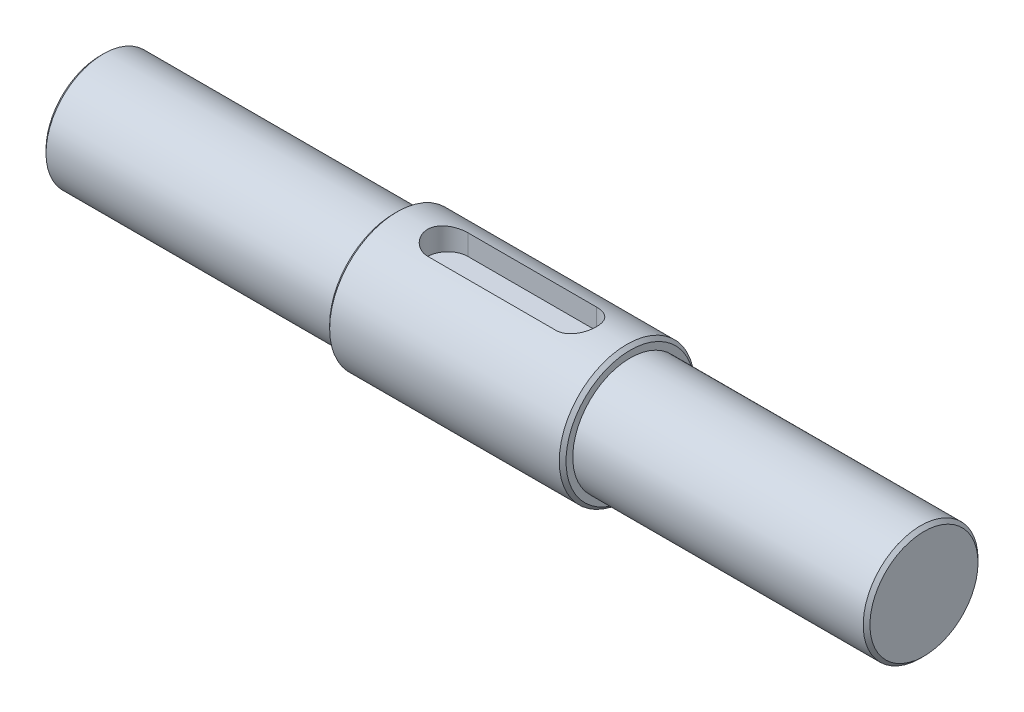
SolidWorks part; units mm, degrees
ref_plane "Front Plane" through (0, 0, 0) normal (0, 0, 1) x (1, 0, 0)
ref_plane "Top Plane" through (0, 0, 0) normal (0, 1, 0) x (1, 0, 0)
ref_plane "Right Plane" through (0, 0, 0) normal (1, 0, 0) x (0, 0, -1)
ref_plane "Plane1" through (0, 0, 0) normal (0, 0, -1) x (-1, 0, 0)
sketch "Sketch1" plane through (0, 0, 0) normal (0, 0, -1) x (-1, 0, 0)
  line L0 (-78.5, 10) -> (-78.5, 0)
  line L1 (-78.5, 0) -> (-43.5, 0)
  line L2 (-43.5, 0) -> (-43.5, 10)
  line L3 (-43.5, 10) -> (-78.5, 10)
  line L4 (-78.5, 0) -> (-43.5, 0) construction
  dimension "D1" = 35
  dimension "D2" = 10
revolve "Revolve1" add sketch "Sketch1" angle 360 about L4
sketch "Sketch2" plane through (78.5, 0, 0) normal (1, 0, 0) x (0, 0, -1)
  circle A0 centre (0, 0) radius 8.5
  dimension "D1" = 17
extrude "Boss-Extrude1" add sketch "Sketch2" along normal blind 43.5
sketch "Sketch3" plane through (43.5, 0, 0) normal (-1, 0, 0) x (0, 0, 1)
  circle A0 centre (0, 0) radius 8.5
  dimension "D1" = 17
extrude "Boss-Extrude2" add sketch "Sketch3" along normal blind 43.5
imported_body "Surface-Imported1"
ref_plane "Plane2" through (0, 6.5, 0) normal (0, -1, 0) x (1, 0, 0)
sketch "Sketch4" plane through (0, 6.5, 0) normal (0, -1, 0) x (1, 0, 0)
  line L0 (70.5, 3) -> (51.5, 3)
  line L1 (51.5, -3) -> (70.5, -3)
  arc A0 (70.5, -3) -> (70.5, 3) centre (70.5, 0) ccw
  arc A1 (51.5, 3) -> (51.5, -3) centre (51.5, 0) ccw
  dimension "D1" = 3
  dimension "D2" = 19
extrude "Cut-Extrude1" cut sketch "Sketch4" against normal up to surface
chamfer "Chamfer1" distance 0.5 angle 45 4 edges at (0, 0, 8.5) (43.5, 0, 10) (122, 0, -8.5) (78.5, 0, 10)
